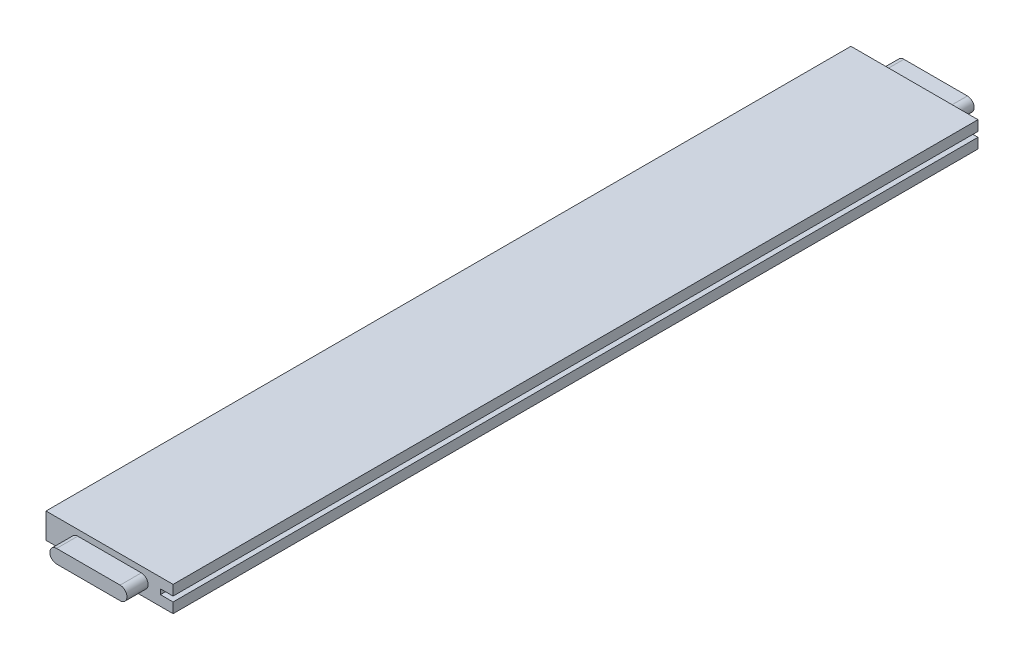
SolidWorks part; units mm, degrees
ref_plane "Alzado" through (0, 0, 0) normal (0, 0, 1) x (1, 0, 0)
ref_plane "Planta" through (0, 0, 0) normal (0, 1, 0) x (1, 0, 0)
ref_plane "Vista lateral" through (0, 0, 0) normal (1, 0, 0) x (0, 0, -1)
sketch "Croquis1" plane through (0, 0, 0) normal (0, 0, 1) x (1, 0, 0)
  line L0 (85, 17.5) -> (-85, -17.5) construction
  line L1 (-85, 17.5) -> (85, 17.5)
  line L2 (-85, 17.5) -> (-85, -17.5)
  line L3 (-85, -17.5) -> (85, -17.5)
  line L4 (85, 17.5) -> (85, -17.5)
extrude "Extruir1" add sketch "Croquis1" along normal mid plane 1050
sketch "Croquis2" plane through (0, 0, 0) normal (0, 0, 1) x (1, 0, 0)
  line L0 (85, -17.5) -> (85, 17.5) construction
  line L1 (-85, 17.5) -> (85, 17.5)
  line L2 (-85, 17.5) -> (-85, 10)
  line L3 (-75, 15) -> (75, 15)
  line L4 (85, 17.5) -> (85, 10)
  line L5 (-85, 17.5) -> (-85, -17.5) construction
  line L6 (85, -17.5) -> (-85, -17.5)
  line L7 (85, -17.5) -> (85, -10)
  line L8 (75, -15) -> (-75, -15)
  line L9 (-85, -17.5) -> (-85, -10)
  line L10 (0, 0) -> (-85.2733, 0) construction
  line L11 (0, 0) -> (0, 19.2981) construction
  line L13 (-85, 10) -> (-85, -10)
  line L15 (-75, 15) -> (-75, -15)
  line L16 (75, 15) -> (75, -15)
  line L18 (85, 10) -> (85, -10)
  dimension "D1" = 30
  dimension "D2" = 150
extrude "Cepillado -Regruesado" cut sketch "Croquis2" against normal through all and the other way through all
sketch "Croquis3" plane through (0, 15, 0) normal (0, 1, 0) x (1, 0, 0)
  line L0 (75, 525) -> (-75, 525) construction
  line L1 (-75, 525) -> (75, 525)
  line L2 (-75, 525) -> (-75, 500)
  line L3 (-75, 500) -> (75, 500)
  line L4 (75, 525) -> (75, 500)
  line L5 (-75, 525) -> (-75, -525) construction
  line L6 (75, 525) -> (75, -525) construction
  line L7 (0, 0) -> (299.0225, 0) construction
  line L8 (75, -525) -> (-75, -525)
  line L9 (75, -525) -> (75, -500)
  line L10 (75, -500) -> (-75, -500)
  line L11 (-75, -525) -> (-75, -500)
  dimension "D1" = 1000
extrude "Largo - Corte" cut sketch "Croquis3" against normal through all
sketch "Croquis5" plane through (0, 0, -500) normal (0, 0, -1) x (-1, 0, 0)
  line L0 (75, -15) -> (75, 15) construction
  line L1 (-60, -3) -> (-75, -3)
  line L2 (-60, -3) -> (-60, 3)
  line L3 (-60, 3) -> (-75, 3)
  line L4 (-75, -3) -> (-75, 3)
  line L5 (75, 0) -> (-75, 0) construction
  line L6 (-75, -15) -> (-75, 15) construction
  dimension "D1" = 15
  dimension "D2" = 6
extrude "Ranurado - Tupí" cut sketch "Croquis5" against normal through all
sketch "Croquis4" plane through (0, 0, 500) normal (0, 0, 1) x (1, 0, 0)
  line L0 (-37.5, 0) -> (37.5, 0) construction
  line L1 (-37.5, 8) -> (37.5, 8)
  line L2 (-37.5, -8) -> (37.5, -8)
  line L7 (75, 15) -> (-75, 15)
  line L8 (-75, 15) -> (-75, -15)
  line L9 (-75, -15) -> (75, -15)
  line L10 (75, -15) -> (75, -3)
  line L11 (75, 15) -> (-75, 15)
  line L12 (-75, 15) -> (-75, -15)
  line L13 (-75, -15) -> (75, -15)
  line L14 (75, -15) -> (75, -3)
  line L19 (60, -3) -> (60, 3)
  line L20 (60, -3) -> (60, 3)
  line L21 (75, -3) -> (60, -3)
  line L22 (75, -3) -> (60, -3)
  line L23 (75, 3) -> (75, 15)
  line L24 (75, 3) -> (75, 15)
  line L25 (60, 3) -> (75, 3)
  line L26 (60, 3) -> (75, 3)
  arc A0 (-37.5, 8) -> (-37.5, -8) centre (-37.5, 0) ccw
  arc A1 (37.5, -8) -> (37.5, 8) centre (37.5, 0) ccw
  point P3 (0, 0)
  dimension "D2" = 8
  dimension "D1" = 75
  dimension "D3" = 0
extrude "Espiga" cut sketch "Croquis4" against normal blind 25
mirror "Simetría1" about plane through (0, 0, 0) normal (0, 0, 1) of "Espiga"
